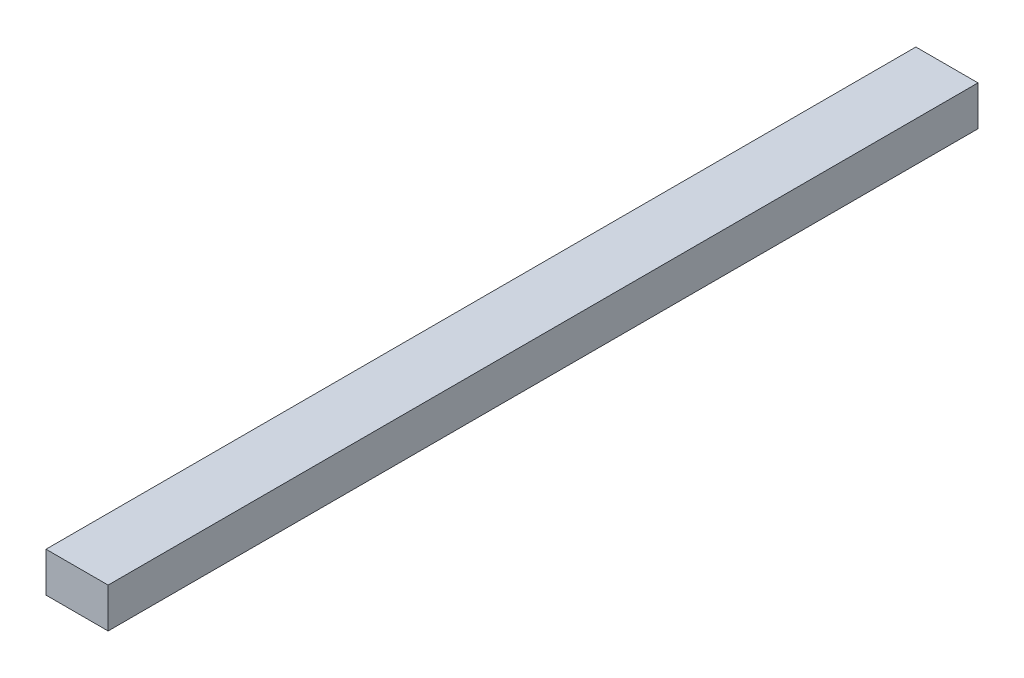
SolidWorks part; units mm, degrees
ref_plane "Alzado" through (0, 0, 0) normal (0, 0, 1) x (1, 0, 0)
ref_plane "Planta" through (0, 0, 0) normal (0, 1, 0) x (1, 0, 0)
ref_plane "Vista lateral" through (0, 0, 0) normal (1, 0, 0) x (0, 0, -1)
sketch "Croquis1" plane through (0, 0, 0) normal (0, 0, 1) x (1, 0, 0)
  line L0 (27.5, 17.5) -> (-27.5, -17.5) construction
  line L1 (-27.5, 17.5) -> (27.5, 17.5)
  line L2 (-27.5, 17.5) -> (-27.5, -17.5)
  line L3 (-27.5, -17.5) -> (27.5, -17.5)
  line L4 (27.5, 17.5) -> (27.5, -17.5)
extrude "Extruir1" add sketch "Croquis1" along normal mid plane 700
sketch "Croquis2" plane through (0, 0, 0) normal (0, 0, 1) x (1, 0, 0)
  line L0 (-25, 16) -> (-25, -16)
  line L1 (-25, -16) -> (25, -16)
  line L2 (25, -16) -> (25, 16)
  line L3 (25, 16) -> (-25, 16)
  line L4 (25, 16) -> (-25, -16) construction
  line L9 (-27.5, 17.5) -> (-27.5, -17.5)
  line L10 (-27.5, -17.5) -> (27.5, -17.5)
  line L11 (27.5, -17.5) -> (27.5, 17.5)
  line L12 (27.5, 17.5) -> (-27.5, 17.5)
  line L13 (-27.5, 17.5) -> (-27.5, -17.5)
  line L14 (-27.5, -17.5) -> (27.5, -17.5)
  line L15 (27.5, -17.5) -> (27.5, 17.5)
  line L16 (27.5, 17.5) -> (-27.5, 17.5)
  dimension "D1" = 0
  dimension "D2" = 50
  dimension "D3" = 32
extrude "Cepillado" cut sketch "Croquis2" against normal through all and the other way through all
